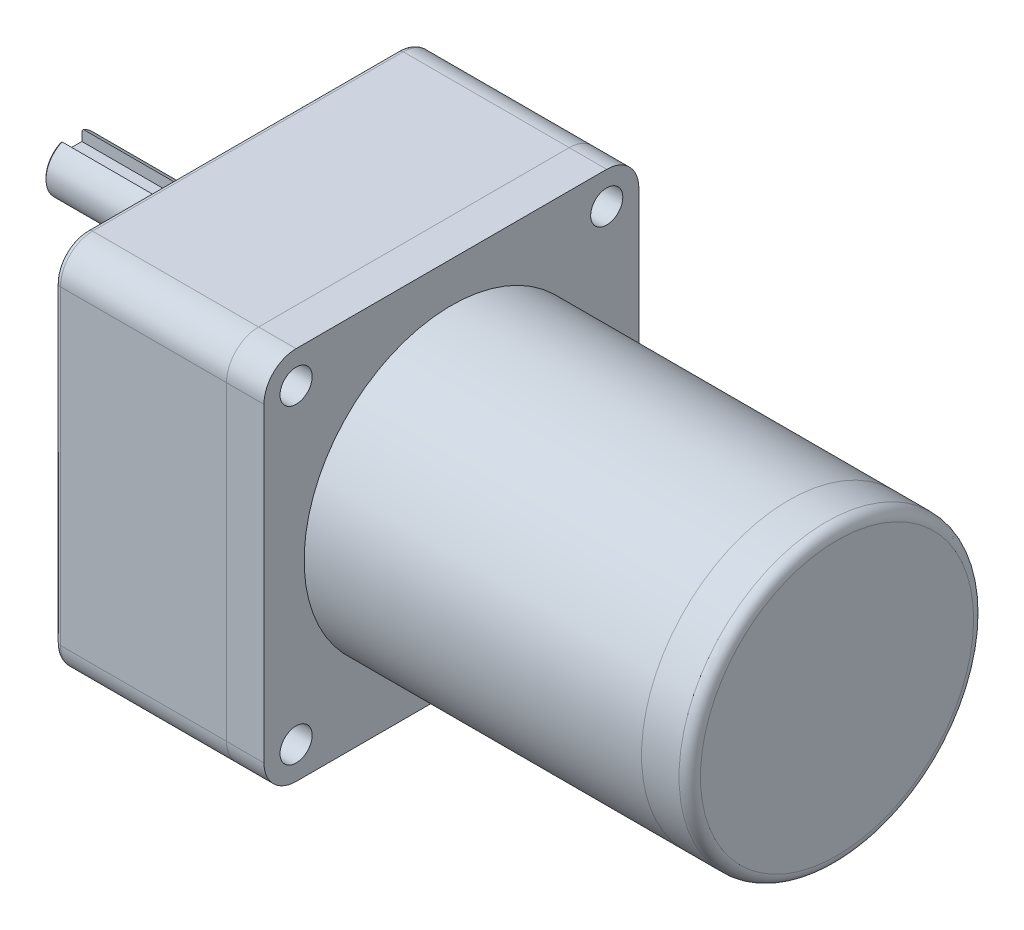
SolidWorks part; units mm, degrees
ref_plane "前视基准面" through (0, 0, 0) normal (0, 0, 1) x (1, 0, 0)
ref_plane "上视基准面" through (0, 0, 0) normal (0, 1, 0) x (1, 0, 0)
ref_plane "右视基准面" through (0, 0, 0) normal (1, 0, 0) x (0, 0, -1)
sketch "草图1" plane through (0, 0, 0) normal (1, 0, 0) x (0, 0, -1)
  line L1 (29, -35) -> (-29, -35)
  line L2 (35, -29) -> (35, 29)
  line L3 (29, 35) -> (-29, 35)
  line L4 (-35, -29) -> (-35, 29)
  line L5 (35, -35) -> (-35, 35) construction
  line L6 (35, 35) -> (-35, -35) construction
  arc A0 (-29, -35) -> (-35, -29) centre (-29, -29) cw
  arc A1 (29, -35) -> (35, -29) centre (29, -29) ccw
  arc A2 (35, 29) -> (29, 35) centre (29, 29) ccw
  arc A3 (-29, 35) -> (-35, 29) centre (-29, 29) ccw
  point P0 (0, 0)
  dimension "D1" = 6
extrude "凸台-拉伸1" add sketch "草图1" along normal blind 32
sketch "草图2" plane through (32, 0, 0) normal (1, 0, 0) x (0, 0, -1)
  line L0 (29, 35) -> (-29, 35) construction
  line L1 (-29, -35) -> (29, -35)
  line L2 (-35, -29) -> (-35, 29)
  line L3 (-29, 35) -> (29, 35)
  line L4 (35, -29) -> (35, 29)
  line L5 (-35, -35) -> (35, 35) construction
  line L6 (-35, 35) -> (35, -35) construction
  arc A0 (29, 35) -> (35, 29) centre (29, 29) cw
  arc A1 (29, -35) -> (35, -29) centre (29, -29) ccw
  arc A2 (-29, -35) -> (-35, -29) centre (-29, -29) cw
  arc A3 (-35, 29) -> (-29, 35) centre (-29, 29) cw
  point P0 (0, 0)
  dimension "D1" = 6
extrude "凸台-拉伸2" add sketch "草图2" along normal blind 7 separate body
fillet "圆角1" radius 1 8 edges at (0, -35, 0) (0, -33.2426, -33.2426) (0, 0, -35) (0, 33.2426, -33.2426) (0, 35, 0) (0, 33.2426, 33.2426) (0, 0, 35) (0, -33.2426, 33.2426)
sketch "草图3" plane through (39, 0, 0) normal (1, 0, 0) x (0, 0, -1)
  circle A0 centre (0, 0) radius 27.5
extrude "凸台-拉伸3" add sketch "草图3" along normal blind 63 separate body
sketch "草图4" plane through (102, 0, 0) normal (1, 0, 0) x (0, 0, -1)
  circle A0 centre (0, 0) radius 27.5
extrude "凸台-拉伸4" add sketch "草图4" along normal blind 9 separate body
fillet "圆角2" radius 2 1 edges at (111, 0, -27.5)
sketch "草图5" plane through (0, 0, 0) normal (-1, 0, 0) x (0, 0, 1)
  point P19 (-28.9914, 28.9914)
  point P20 (28.9914, 28.9914)
  point P21 (28.9914, -28.9914)
  point P22 (-28.9914, -28.9914)
hole_wizard "M5 螺纹孔1" positions "3D草图1" profile "草图6" tap size "M5" standard "GB"
sketch3d "3D草图1"
  point P0 (0, 28.9914, -28.9914)
  point P3 (0, -28.9914, -28.9914)
  point P6 (0, -28.9914, 28.9914)
  point P9 (0, 28.9914, 28.9914)
sketch "草图6" plane through (0, 28.9914, -28.9914) normal (0, 1, 0) x (0, 0, 1)
  line L0 (0, 0) -> (0, 15.2618)
  line L1 (0, 15.2618) -> (2.1, 14)
  line L2 (2.1, 14) -> (2.1, 0)
  line L5 (2.1, 0) -> (0, 0)
  line L10 (0, 15.2618) -> (-2.1, 14) construction
  line L11 (0, -6.35) -> (0, 107.95) construction
  dimension "螺纹孔钻头直径" = 4.2
  dimension "螺纹孔钻头深度" = 14
  dimension "导头角度" = 118
sketch "草图7" plane through (39, 0, 0) normal (1, 0, 0) x (0, 0, -1)
  circle A1 centre (-29, 29) radius 3
  circle A2 centre (29, 29) radius 3
  circle A3 centre (29, -29) radius 3
  circle A4 centre (-29, -29) radius 3
extrude "切除-拉伸1" cut sketch "草图7" against normal blind 25
sketch "草图8" plane through (0, 0, 0) normal (-1, 0, 0) x (0, 0, 1)
  circle A0 centre (0, 15) radius 12
extrude "凸台-拉伸5" add sketch "草图8" along normal blind 3 separate body
sketch "草图9" plane through (-3, 0, 0) normal (-1, 0, 0) x (0, 0, 1)
  circle A0 centre (0, 15) radius 5
extrude "凸台-拉伸6" add sketch "草图9" along normal blind 29 separate body
fillet "圆角3" radius 0.5 1 edges at (-3, 15, 12)
sketch "草图10" plane through (0, 0, 0) normal (-1, 0, 0) x (0, 0, 1)
  circle A0 centre (0, 0) radius 30
extrude "切除-拉伸2" cut sketch "草图10" against normal blind 0.5
ref_plane "基准面1" through (0, 20, 0) normal (0, 1, 0) x (1, 0, 0)
sketch "草图11" plane through (0, 20, 0) normal (0, 1, 0) x (1, 0, 0)
  line L1 (-32, 5) -> (-32, -5) construction
  line L2 (-9, 2) -> (-32, 2)
  line L3 (-32, 2) -> (-32, -2)
  line L4 (-32, -2) -> (-9, -2)
  arc A0 (-9, -2) -> (-9, 2) centre (-9, 0) ccw
extrude "切除-拉伸3" cut sketch "草图11" against normal blind 2.5
chamfer "倒角1" distance 0.3 angle 45 1 edges at (-32, 10, 0)
